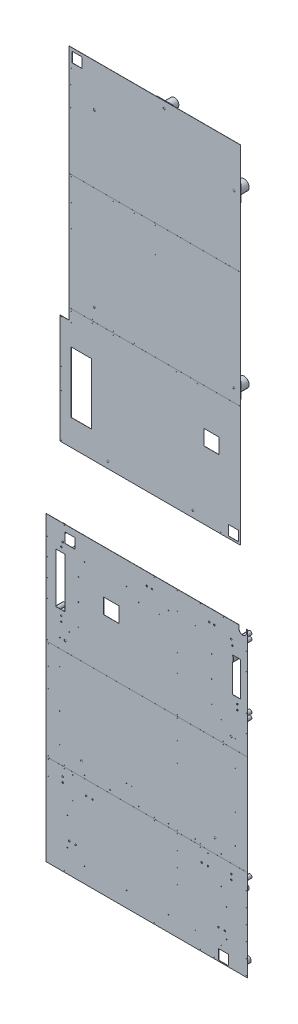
SolidWorks part; units mm, degrees
ref_plane "Plan de face" through (0, 0, 0) normal (0, 0, 1) x (1, 0, 0)
ref_plane "Plan de dessus" through (0, 0, 0) normal (0, 1, 0) x (1, 0, 0)
ref_plane "Plan de droite" through (0, 0, 0) normal (1, 0, 0) x (0, 0, -1)
sketch "Esquisse1" plane through (0, 0, 0) normal (0, 0, 1) x (1, 0, 0)
  line L4 (-30274.8157, 61703.558) -> (-30274.8157, 64815.0579)
  line L5 (-32386.0649, 61703.558) -> (-30274.8157, 61703.558)
  line L6 (-32386.0649, 64815.0579) -> (-32386.0649, 61703.558)
  line L7 (-30413.5787, 64815.0579) -> (-32386.0649, 64815.0579)
  line L11 (-30274.8157, 64815.0579) -> (-30338.5787, 64815.0579)
  line L12 (-30338.5787, 64815.0579) -> (-30338.5787, 64781.658)
  line L13 (-30413.5787, 64781.658) -> (-30413.5787, 64815.0579)
  line L15 (-30398.0256, 64522.8486) -> (-30479.4053, 64522.8486)
  line L16 (-30398.0256, 64522.8486) -> (-30398.0256, 64180.3914)
  line L17 (-30398.0256, 64180.3914) -> (-30479.4053, 64180.3914)
  line L18 (-30479.4053, 64522.8486) -> (-30479.4053, 64180.3914)
  line L19 (-31610.4628, 64380.1958) -> (-31762.7676, 64380.1958)
  line L20 (-31610.4628, 64380.1958) -> (-31610.4628, 64227.6279)
  line L21 (-31610.4628, 64227.6279) -> (-31762.7676, 64227.6279)
  line L22 (-31762.7676, 64380.1958) -> (-31762.7676, 64227.6279)
  line L23 (-32148.6171, 64557.0087) -> (-32238.8866, 64557.0087)
  line L24 (-32148.6171, 64557.0087) -> (-32148.6171, 64059.3316)
  line L25 (-32148.6171, 64059.3316) -> (-32238.8866, 64059.3316)
  line L26 (-32238.8866, 64557.0087) -> (-32238.8866, 64059.3316)
  arc A1 (-30413.5787, 64781.658) -> (-30338.5787, 64781.658) centre (-30376.0787, 64781.658) ccw
  arc A2 (-30413.5787, 64781.658) -> (-30338.5787, 64781.658) centre (-30376.0787, 64781.658) ccw construction
extrude "Boss.-Extru.1" add sketch "Esquisse1" along normal blind 1.5
hole_wizard "43 M4 K" positions "Esquisse3" profile "Esquisse4" tap size "M4" standard "ISO"
sketch "Esquisse3" plane through (0, 0, 1.5) normal (0, 0, 1) x (1, 0, 0)
  point P0 (-31954.79, 64586.5543)
  point P3 (-31535.2771, 64585.3859)
  point P6 (-31413.4414, 64507.7294)
  point P9 (-31210.0566, 64507.7294)
  point P12 (-31116.2214, 64586.6559)
  point P15 (-30849.4479, 64589.0943)
  point P18 (-30684.3889, 64427.7727)
  point P21 (-30684.3889, 64210.4793)
  point P24 (-30684.3889, 63992.1698)
  point P27 (-30590.4069, 63905.6267)
  point P30 (-30449.4874, 63811.7454)
  point P33 (-30449.4874, 63557.7454)
  point P36 (-30449.4874, 63176.7454)
  point P39 (-30449.4874, 62884.6649)
  point P42 (-30590.4069, 62744.9565)
  point P45 (-30722.3575, 62686.4873)
  point P48 (-30849.4479, 62744.9565)
  point P51 (-31116.2218, 62744.9565)
  point P54 (-31413.4414, 62744.9565)
  point P57 (-31484.4778, 62884.6649)
  point P60 (-31535.2771, 62885.1454)
  point P63 (-31700.3847, 62744.9565)
  point P66 (-31954.79, 62743.7881)
  point P69 (-32071.2906, 62686.4873)
  point P72 (-32200.8831, 62884.6649)
  point P75 (-32200.8831, 63176.7454)
  point P78 (-32200.8831, 63557.7454)
  point P81 (-32199.593, 63811.7454)
  point P84 (-32106.776, 63905.6267)
  point P87 (-32015.2956, 63992.1698)
  point P90 (-32015.2956, 64210.4793)
  point P93 (-32015.2956, 64427.7727)
  point P96 (-32071.1236, 62465.6107)
  point P99 (-32124.6441, 62313.2688)
  point P102 (-32124.5688, 62033.7601)
  point P105 (-31954.79, 61957.5524)
  point P108 (-31535.2771, 61958.3118)
  point P111 (-31116.2218, 61957.5524)
  point P114 (-30849.4479, 61957.5524)
  point P117 (-30590.4069, 61957.5524)
  point P120 (-30537.1513, 62033.7601)
  point P123 (-30537.0761, 62313.2688)
  point P126 (-30590.4069, 62465.6107)
sketch "Esquisse4" plane through (-31954.79, 64586.5543, 1.5) normal (1, 0, 0) x (0, -1, 0)
  line L0 (0, 0) -> (0, 12.4914)
  line L1 (0, 12.4914) -> (1.65, 11.5)
  line L2 (1.65, 11.5) -> (1.65, 0)
  line L5 (1.65, 0) -> (0, 0)
  line L10 (0, 12.4914) -> (-1.65, 11.5) construction
  line L11 (0, -6.35) -> (0, 107.95) construction
  dimension "Diamètre du trou pour taraudage" = 3.3
  dimension "Profondeur du trou pour taraudage" = 11.5
  dimension "Angle de pointe" = 118
hole_wizard "Dégagement 24xM12" positions "Esquisse5" profile "Esquisse6" hole size "M14" standard "ISO"
sketch "Esquisse5" plane through (0, 0, 1.5) normal (0, 0, 1) x (1, 0, 0)
  point P0 (-32172.1899, 64652.1668)
  point P3 (-32185.7029, 64603.1405)
  point P6 (-31332.2615, 64690.7484)
  point P9 (-31281.4615, 64690.7484)
  point P12 (-30709.9615, 64690.7484)
  point P15 (-30659.1615, 64690.7484)
  point P18 (-30492.237, 64652.153)
  point P21 (-30478.5726, 64603.2863)
  point P24 (-30429.1641, 64069.7197)
  point P27 (-30429.1665, 64120.5663)
  point P30 (-30488.3987, 62623.0581)
  point P33 (-30488.3987, 62572.2581)
  point P36 (-30722.2589, 62575.083)
  point P39 (-30785.7589, 62575.083)
  point P42 (-31875.0887, 62575.083)
  point P45 (-31938.5887, 62575.083)
  point P48 (-32172.6372, 62572.3851)
  point P51 (-32172.6372, 62623.1851)
  point P54 (-32186.8864, 63955.417)
  point P57 (-32186.8888, 64006.2636)
  point P60 (-32106.5081, 62098.96)
  point P63 (-32043.0081, 62098.96)
  point P66 (-30617.5601, 62098.96)
  point P69 (-30554.0601, 62098.96)
sketch "Esquisse6" plane through (-32172.1899, 64652.1668, 1.5) normal (1, 0, 0) x (0, -1, 0)
  line L0 (0, 0) -> (0, 16.0065)
  line L1 (0, 16.0065) -> (7.5, 11.5)
  line L2 (7.5, 11.5) -> (7.5, 0)
  line L5 (7.5, 0) -> (0, 0)
  line L10 (0, 16.0065) -> (-7.5, 11.5) construction
  line L11 (0, -6.35) -> (0, 107.95) construction
  dimension "Diamètre du perçage" = 15
  dimension "Profondeur du perçage" = 11.5
  dimension "Angle de pointe" = 118
hole_wizard "Dégagement 4x M18" positions "Esquisse7" profile "Esquisse8" hole size "M20" standard "ISO"
sketch "Esquisse7" plane through (0, 0, 1.5) normal (0, 0, 1) x (1, 0, 0)
  point P0 (-31983.7711, 62855.4119)
  point P3 (-30652.2523, 62855.4119)
  point P6 (-30489.6923, 63812.4331)
  point P9 (-32146.3311, 63812.4331)
sketch "Esquisse8" plane through (-31983.7711, 62855.4119, 1.5) normal (1, 0, 0) x (0, -1, 0)
  line L0 (0, 0) -> (0, 18.1095)
  line L1 (0, 18.1095) -> (11, 11.5)
  line L2 (11, 11.5) -> (11, 0)
  line L5 (11, 0) -> (0, 0)
  line L10 (0, 18.1095) -> (-11, 11.5) construction
  line L11 (0, -6.35) -> (0, 107.95) construction
  dimension "Diamètre du perçage" = 22
  dimension "Profondeur du perçage" = 11.5
  dimension "Angle de pointe" = 118
sketch "Esquisse9" plane through (0, 0, 1.5) normal (0, 0, 1) x (1, 0, 0)
  line L1 (-32197.6223, 66600.1627) -> (-30397.6223, 66600.1627)
  line L2 (-32197.6223, 66600.1627) -> (-32197.6223, 65510.1627)
  line L3 (-32197.6223, 65510.1627) -> (-30397.6223, 65510.1627)
  line L4 (-30397.6223, 66600.1627) -> (-30397.6223, 65510.1627)
  line L5 (-32107.6223, 66600.2627) -> (-30397.6223, 66600.2627)
  line L6 (-32107.6223, 66600.2627) -> (-32107.6223, 68970.1627)
  line L7 (-32107.6223, 68970.1627) -> (-30397.6223, 68970.1627)
  line L8 (-30397.6223, 66600.2627) -> (-30397.6223, 68970.1627)
  line L9 (-32087.6223, 66379.8355) -> (-31884.4368, 66379.8355)
  line L10 (-32087.6223, 66379.8355) -> (-32087.6223, 65770.2789)
  line L11 (-32087.6223, 65770.2789) -> (-31884.4368, 65770.2789)
  line L12 (-31884.4368, 66379.8355) -> (-31884.4368, 65770.2789)
  line L13 (-30764.4609, 66338.3373) -> (-30612.0718, 66338.3373)
  line L14 (-30764.4609, 66338.3373) -> (-30764.4609, 66185.9479)
  line L15 (-30764.4609, 66185.9479) -> (-30612.0718, 66185.9479)
  line L16 (-30612.0718, 66338.3373) -> (-30612.0718, 66185.9479)
  point P12 (-30427.6223, 68930.1627)
  point P13 (-30972.168, 65540.1627)
  dimension "D1" = 40
  dimension "D2" = 30
  dimension "D3" = 1710
  dimension "D4" = 30
  dimension "D5" = 0.1
  dimension "D6" = 1800
  dimension "D7" = 1090
extrude "Boss.-Extru.2" add sketch "Esquisse9" against normal up to surface (1.5 mm away) separate body
hole_wizard "Dégagement M202" positions "Esquisse10" profile "Esquisse11" hole size "M20" standard "ISO"
sketch "Esquisse10" plane through (0, 0, 1.5) normal (0, 0, 1) x (1, 0, 0)
  point P0 (-30463.5822, 68544.1973)
  point P3 (-31158.9847, 68906.1215)
  point P6 (-31854.3872, 68544.1973)
  point P9 (-31854.3872, 66839.3436)
  point P12 (-30463.5822, 66839.3436)
  point P15 (-31720.6404, 65575.7835)
  point P18 (-30872.3407, 65575.7835)
sketch "Esquisse11" plane through (-30463.5822, 68544.1973, 1.5) normal (1, 0, 0) x (0, -1, 0)
  line L0 (0, 0) -> (0, 18.1095)
  line L1 (0, 18.1095) -> (11, 11.5)
  line L2 (11, 11.5) -> (11, 0)
  line L5 (11, 0) -> (0, 0)
  line L10 (0, 18.1095) -> (-11, 11.5) construction
  line L11 (0, -6.35) -> (0, 107.95) construction
  dimension "Diamètre du perçage" = 22
  dimension "Profondeur du perçage" = 11.5
  dimension "Angle de pointe" = 118
sketch "Esquisse12" plane through (0, 0, 0) normal (0, 0, -1) x (-1, 0, 0)
  line L1 (32174.2711, 63866.4081) -> (32061.8311, 63866.4081)
  line L2 (32174.2711, 63866.4081) -> (32174.2711, 63754.9331)
  line L3 (32174.2711, 63754.9331) -> (32061.8311, 63754.9331)
  line L4 (32061.8311, 63866.4081) -> (32061.8311, 63754.9331)
  line L5 (30574.1816, 63869.7909) -> (30459.1923, 63869.7909)
  line L6 (30574.1816, 63869.7909) -> (30574.1816, 63754.9331)
  line L7 (30574.1816, 63754.9331) -> (30459.1923, 63754.9331)
  line L12 (30459.1923, 63869.7909) -> (30459.1923, 63754.9331)
  line L13 (32041.0408, 62939.0366) -> (31929.7961, 62939.0366)
  line L14 (32041.0408, 62939.0366) -> (32041.0408, 62827.6128)
  line L15 (32041.0408, 62827.6128) -> (31929.7961, 62827.6128)
  line L20 (31929.7961, 62939.0366) -> (31929.7961, 62827.6128)
  line L21 (30594.8555, 62939.8358) -> (30706.2273, 62939.8358)
  line L22 (30594.8555, 62939.8358) -> (30594.8555, 62827.4719)
  line L23 (30594.8555, 62827.4719) -> (30706.2273, 62827.4719)
  line L28 (30706.2273, 62939.8358) -> (30706.2273, 62827.4719)
  circle A0 centre (30520.69, 64488.182) radius 52.524 construction
  circle A1 centre (30684.5431, 64599.6577) radius 25.3982 construction
  circle A2 centre (31306.7988, 64599.6577) radius 25.3982
  circle A3 centre (31306.7988, 64599.6577) radius 25.3982 construction
  circle A4 centre (30684.5431, 64599.6577) radius 25.3982
  circle A5 centre (32094.1428, 64599.6577) radius 25.3982 construction
  circle A6 centre (30424.9787, 61870.558) radius 31.75
  circle A7 centre (32095.4901, 64488.6966) radius 52.524 construction
  circle A8 centre (30444.9787, 62483.658) radius 31.75
  circle A9 centre (32094.1428, 64152.6495) radius 25.3982 construction
  circle A10 centre (32219.1687, 62483.658) radius 31.75
  circle A11 centre (32095.4901, 64025.4006) radius 52.524 construction
  circle A12 centre (32239.1737, 61870.558) radius 31.75
  circle A13 centre (30520.69, 64025.2597) radius 52.524 construction
  circle A14 centre (30520.69, 64025.2597) radius 52.524
  circle A15 centre (32219.1687, 62483.658) radius 31.75 construction
  circle A16 centre (30520.69, 64488.182) radius 52.524
  circle A17 centre (30444.9787, 62483.658) radius 31.75 construction
  circle A18 centre (32095.4901, 64488.6966) radius 52.524
  circle A19 centre (32239.1737, 61870.558) radius 31.75 construction
  circle A20 centre (32095.4901, 64025.4006) radius 52.524
  circle A21 centre (30424.9787, 61870.558) radius 31.75 construction
  circle A22 centre (32094.1428, 64152.6495) radius 25.3982
  circle A24 centre (32094.1428, 64599.6577) radius 25.3982
extrude "PIED32" add sketch "Esquisse12" along normal blind 100 separate body
sketch "Esquisse13" plane through (0, 0, 0) normal (0, 0, -1) x (-1, 0, 0)
  circle A0 centre (30404.5787, 62597.658) radius 18.8884 construction
  circle A1 centre (32259.5787, 62597.658) radius 18.8884 construction
  circle A2 centre (30404.5787, 62597.658) radius 18.8884
  circle A3 centre (32259.5787, 63970.158) radius 18.8884 construction
  circle A4 centre (32259.5787, 62597.658) radius 18.8884
  circle A5 centre (32259.5787, 64020.158) radius 18.8884 construction
  circle A6 centre (32259.5787, 63970.158) radius 18.8884
  circle A7 centre (32259.5787, 64650.158) radius 18.8884 construction
  circle A8 centre (32259.5787, 64020.158) radius 18.8884
  circle A9 centre (32259.5787, 64700.158) radius 18.8884 construction
  circle A10 centre (30404.5787, 63970.158) radius 18.8884
  circle A11 centre (30404.5787, 64650.158) radius 18.8884 construction
  circle A12 centre (30404.5787, 64020.158) radius 18.8884
  circle A13 centre (30404.5786, 64700.158) radius 18.8884 construction
  circle A14 centre (30404.5787, 64650.158) radius 18.8884
  circle A15 centre (30404.5787, 63970.158) radius 18.8884 construction
  circle A16 centre (30404.5786, 64700.158) radius 18.8884
  circle A17 centre (30404.5787, 64020.158) radius 18.8884 construction
  circle A18 centre (32259.5787, 64700.158) radius 18.8884
  circle A20 centre (32259.5787, 64650.158) radius 18.8884
extrude "PIED4" add sketch "Esquisse13" along normal blind 100 separate body
sketch "Esquisse14" plane through (0, 0, 0) normal (0, 0, -1) x (-1, 0, 0)
  circle A0 centre (30463.5822, 68544.1973) radius 50.7964 construction
  arc A1 (30612.9236, 68759.3792) -> (30634.2347, 68756.8847) centre (30622.3209, 68747.3828) ccw construction
  circle A2 centre (31720.6404, 65575.7835) radius 50.7964
  circle A3 centre (31158.9847, 68906.1215) radius 44.1929 construction
  circle A4 centre (30872.3407, 65575.7835) radius 50.7964
  arc A5 (31683.7347, 68756.8847) -> (31705.0459, 68759.3792) centre (31695.6485, 68747.3828) ccw construction
  circle A6 centre (31695.6485, 68747.3828) radius 15.2389
  circle A7 centre (31854.3872, 68544.1973) radius 50.7964 construction
  circle A8 centre (30580.2615, 66534.5653) radius 25.3982
  circle A9 centre (31854.3872, 66839.3436) radius 50.7964 construction
  circle A10 centre (32019.0691, 66534.5653) radius 25.3982
  circle A11 centre (32019.0691, 66534.5653) radius 25.3982 construction
  circle A12 centre (31854.3872, 68544.1973) radius 50.7964
  circle A13 centre (30580.2615, 66534.5653) radius 25.3982 construction
  circle A14 centre (30463.5822, 68544.1973) radius 50.7964
  circle A15 centre (30463.5822, 66839.3436) radius 50.7964 construction
  circle A16 centre (31854.3872, 66839.3436) radius 50.7964
  circle A17 centre (31543.2594, 65759.9204) radius 50.7964 construction
  circle A18 centre (30463.5822, 66839.3436) radius 50.7964
  arc A19 (31669.844, 65575.7835) -> (31765.1877, 65600.1927) centre (31720.6404, 65575.7835) ccw construction
  circle A20 centre (31543.2594, 65759.9204) radius 50.7964
  circle A21 centre (30872.3407, 65575.7835) radius 50.7964 construction
  circle A22 centre (31158.9847, 68906.1215) radius 44.1929
  circle A24 centre (30622.3209, 68747.3828) radius 15.2389
extrude "PIED1" add sketch "Esquisse14" along normal blind 100 separate body
sketch "Esquisse15" plane through (0, 0, 0) normal (0, 0, -1) x (-1, 0, 0)
  line L8 (30546.1263, 68461.6531) -> (30546.1263, 68626.7414)
  line L9 (30546.1263, 68626.7414) -> (30403.2615, 68626.7414)
  line L10 (30403.2615, 68626.7414) -> (30403.2615, 68461.6531)
  line L11 (30403.2615, 68461.6531) -> (30546.1263, 68461.6531)
  line L16 (31076.4406, 68823.5774) -> (31241.5289, 68823.5774)
  line L17 (31076.4406, 68966.4422) -> (31076.4406, 68823.5774)
  line L18 (31241.5289, 68966.4422) -> (31076.4406, 68966.4422)
  line L19 (31241.5289, 68823.5774) -> (31241.5289, 68966.4422)
  line L24 (31914.708, 68626.7414) -> (31771.8431, 68626.7414)
  line L25 (31914.708, 68461.6531) -> (31914.708, 68626.7414)
  line L26 (31771.8431, 68461.6531) -> (31914.708, 68461.6531)
  line L27 (31771.8431, 68626.7414) -> (31771.8431, 68461.6531)
  line L32 (30403.2615, 66763.149) -> (30546.1263, 66763.149)
  line L33 (30403.2615, 66921.8877) -> (30403.2615, 66763.149)
  line L34 (30546.1263, 66921.8877) -> (30403.2615, 66921.8877)
  line L35 (30546.1263, 66763.149) -> (30546.1263, 66921.8877)
  line L40 (31914.708, 66921.8877) -> (31771.8431, 66921.8877)
  line L41 (31771.8431, 66921.8877) -> (31771.8431, 66756.7994)
  line L42 (31771.8431, 66756.7994) -> (31914.708, 66756.7994)
  line L43 (31914.708, 66756.7994) -> (31914.708, 66921.8877)
  line L48 (31803.1845, 65639.279) -> (31638.0962, 65639.279)
  line L49 (31638.0962, 65639.279) -> (31638.0962, 65515.4628)
  line L50 (31638.0962, 65515.4628) -> (31803.1845, 65515.4628)
  line L51 (31803.1845, 65515.4628) -> (31803.1845, 65639.279)
  line L56 (30954.8849, 65639.279) -> (30789.7966, 65639.279)
  line L57 (30789.7966, 65639.279) -> (30789.7966, 65515.4628)
  line L58 (30789.7966, 65515.4628) -> (30954.8849, 65515.4628)
  line L59 (30954.8849, 65515.4628) -> (30954.8849, 65639.279)
  circle A2 centre (30463.5822, 68544.1973) radius 50.7964
  circle A4 centre (31854.3872, 68544.1973) radius 50.7964
  circle A6 centre (31158.9847, 68906.1215) radius 44.1929
  circle A8 centre (31854.3872, 66839.3436) radius 50.7964
  circle A10 centre (30463.5822, 66839.3436) radius 50.7964
  circle A12 centre (31720.6404, 65575.7835) radius 50.7964
  circle A14 centre (30872.3407, 65575.7835) radius 50.7964
extrude "PIED2" add sketch "Esquisse15" along normal blind 10 separate body
sketch "Esquisse16" plane through (0, 0, 0) normal (0, 0, -1) x (-1, 0, 0)
  line L0 (31610.4628, 64380.1958) -> (31762.7676, 64380.1958) construction
  line L1 (31600.4628, 64390.1958) -> (31772.7676, 64390.1958)
  line L2 (31600.4628, 64390.1958) -> (31600.4628, 64217.6279)
  line L3 (31600.4628, 64217.6279) -> (31772.7676, 64217.6279)
  line L4 (31772.7676, 64390.1958) -> (31772.7676, 64217.6279)
  line L5 (31762.7676, 64227.6279) -> (31610.4628, 64227.6279) construction
  line L6 (31610.4628, 64227.6279) -> (31610.4628, 64380.1958) construction
  line L7 (31762.7676, 64380.1958) -> (31762.7676, 64227.6279) construction
  dimension "D1" = 10
  dimension "D2" = 10
  dimension "D3" = 10
  dimension "D4" = 10
sketch "Esquisse17" plane through (0, 0, 0) normal (0, 0, -1) x (-1, 0, 0)
  line L1 (30274.8157, 61703.558) -> (32386.0649, 61703.558)
  line L2 (30274.8157, 61703.558) -> (30274.8157, 61805.1634)
  line L3 (30274.8157, 61805.1634) -> (32386.0649, 61805.1634)
  line L4 (32386.0649, 61703.558) -> (32386.0649, 61805.1634)
  dimension "D1" = 101.6054
extrude "Enlèv. mat.-Extru.1" cut sketch "Esquisse17" against normal blind 10
sketch "Esquisse18" plane through (0, 0, 1.5) normal (0, 0, 1) x (1, 0, 0)
  line L1 (-30274.8157, 64815.0579) -> (-30328.0257, 64815.0579)
  line L2 (-30274.8157, 64815.0579) -> (-30274.8157, 61805.1634)
  line L3 (-30274.8157, 61805.1634) -> (-30328.0257, 61805.1634)
  line L4 (-30328.0257, 64815.0579) -> (-30328.0257, 61805.1634)
  line L5 (-32386.0649, 61805.1634) -> (-32338.0249, 61805.1634)
  line L6 (-32386.0649, 61805.1634) -> (-32386.0649, 64815.0579)
  line L7 (-32386.0649, 64815.0579) -> (-32338.0249, 64815.0579)
  line L8 (-32338.0249, 61805.1634) -> (-32338.0249, 64815.0579)
  dimension "D1" = 48.04
  dimension "D2" = 53.21
extrude "Enlèv. mat.-Extru.2" cut sketch "Esquisse18" against normal blind 10
sketch "Esquisse19" plane through (0, 64815.0579, 0) normal (0, 1, 0) x (1, 0, 0)
  line L4 (-30413.5787, 0) -> (-32338.0249, 0)
  line L5 (-32338.0249, 0) -> (-32338.0249, -1.5)
  line L6 (-32338.0249, -1.5) -> (-30413.5787, -1.5)
  line L7 (-30413.5787, -1.5) -> (-30413.5787, 0)
  line L8 (-30413.5787, 0) -> (-32338.0249, 0)
  line L9 (-32338.0249, 0) -> (-32338.0249, -1.5)
  line L10 (-32338.0249, -1.5) -> (-30413.5787, -1.5)
  line L11 (-30413.5787, -1.5) -> (-30413.5787, 0)
  line L12 (-30338.5787, -1.5) -> (-30328.0257, -1.5)
  line L13 (-30328.0257, -1.5) -> (-30328.0257, 0)
  line L14 (-30328.0257, 0) -> (-30338.5787, 0)
  line L15 (-30338.5787, 0) -> (-30338.5787, -1.5)
  line L16 (-30338.5787, -1.5) -> (-30328.0257, -1.5)
  line L17 (-30328.0257, -1.5) -> (-30328.0257, 0)
  line L18 (-30328.0257, 0) -> (-30338.5787, 0)
  line L19 (-30338.5787, 0) -> (-30338.5787, -1.5)
  dimension "D1" = 0
  dimension "D2" = 0
extrude "Boss.-Extru.7" add sketch "Esquisse19" along normal blind 0.1
sketch "Esquisse20" plane through (0, 0, 0) normal (0, 0, -1) x (-1, 0, 0)
  line L0 (30546.1263, 66763.149) -> (30546.1263, 66921.8877) construction
  line L1 (30546.1263, 66921.8877) -> (30403.2615, 66921.8877) construction
  line L2 (30403.2615, 66921.8877) -> (30403.2615, 66763.149) construction
  line L3 (30403.2615, 66763.149) -> (30546.1263, 66763.149) construction
  line L4 (31914.708, 66756.7994) -> (31914.708, 66921.8877) construction
  line L5 (31914.708, 66921.8877) -> (31771.8431, 66921.8877) construction
  line L6 (31771.8431, 66921.8877) -> (31771.8431, 66756.7994) construction
  line L7 (31771.8431, 66756.7994) -> (31914.708, 66756.7994) construction
  line L8 (30954.8849, 65515.4628) -> (30954.8849, 65639.279) construction
  line L9 (30954.8849, 65639.279) -> (30789.7966, 65639.279) construction
  line L10 (30789.7966, 65639.279) -> (30789.7966, 65515.4628) construction
  line L11 (30789.7966, 65515.4628) -> (30954.8849, 65515.4628) construction
  line L12 (31803.1845, 65515.4628) -> (31803.1845, 65639.279) construction
  line L13 (31803.1845, 65639.279) -> (31638.0962, 65639.279) construction
  line L14 (31638.0962, 65639.279) -> (31638.0962, 65515.4628) construction
  line L15 (31638.0962, 65515.4628) -> (31803.1845, 65515.4628) construction
  line L16 (30546.1263, 66763.149) -> (30546.1263, 66921.8877)
  line L17 (30546.1263, 66921.8877) -> (30403.2615, 66921.8877)
  line L18 (30403.2615, 66921.8877) -> (30403.2615, 66763.149)
  line L19 (30403.2615, 66763.149) -> (30546.1263, 66763.149)
  line L20 (31914.708, 66756.7994) -> (31914.708, 66921.8877)
  line L21 (31914.708, 66921.8877) -> (31771.8431, 66921.8877)
  line L22 (31771.8431, 66921.8877) -> (31771.8431, 66756.7994)
  line L23 (31771.8431, 66756.7994) -> (31914.708, 66756.7994)
  line L24 (30954.8849, 65515.4628) -> (30954.8849, 65639.279)
  line L25 (30954.8849, 65639.279) -> (30789.7966, 65639.279)
  line L26 (30789.7966, 65639.279) -> (30789.7966, 65515.4628)
  line L27 (30789.7966, 65515.4628) -> (30954.8849, 65515.4628)
  line L28 (31803.1845, 65515.4628) -> (31803.1845, 65639.279)
  line L29 (31803.1845, 65639.279) -> (31638.0962, 65639.279)
  line L30 (31638.0962, 65639.279) -> (31638.0962, 65515.4628)
  line L31 (31638.0962, 65515.4628) -> (31803.1845, 65515.4628)
  line L32 (30403.2615, 68461.6531) -> (30546.1263, 68461.6531) construction
  line L33 (30546.1263, 68461.6531) -> (30546.1263, 68626.7414) construction
  line L34 (30546.1263, 68626.7414) -> (30403.2615, 68626.7414) construction
  line L35 (30403.2615, 68626.7414) -> (30403.2615, 68461.6531) construction
  line L36 (31241.5289, 68823.5774) -> (31241.5289, 68966.4422) construction
  line L37 (31241.5289, 68966.4422) -> (31076.4406, 68966.4422) construction
  line L38 (31076.4406, 68966.4422) -> (31076.4406, 68823.5774) construction
  line L39 (31076.4406, 68823.5774) -> (31241.5289, 68823.5774) construction
  line L40 (31914.708, 68461.6531) -> (31914.708, 68626.7414) construction
  line L41 (31914.708, 68626.7414) -> (31771.8431, 68626.7414) construction
  line L42 (31771.8431, 68626.7414) -> (31771.8431, 68461.6531) construction
  line L43 (31771.8431, 68461.6531) -> (31914.708, 68461.6531) construction
  line L44 (30403.2615, 68461.6531) -> (30546.1263, 68461.6531)
  line L45 (30546.1263, 68461.6531) -> (30546.1263, 68626.7414)
  line L46 (30546.1263, 68626.7414) -> (30403.2615, 68626.7414)
  line L47 (30403.2615, 68626.7414) -> (30403.2615, 68461.6531)
  line L48 (31241.5289, 68823.5774) -> (31241.5289, 68966.4422)
  line L49 (31241.5289, 68966.4422) -> (31076.4406, 68966.4422)
  line L50 (31076.4406, 68966.4422) -> (31076.4406, 68823.5774)
  line L51 (31076.4406, 68823.5774) -> (31241.5289, 68823.5774)
  line L52 (31914.708, 68461.6531) -> (31914.708, 68626.7414)
  line L53 (31914.708, 68626.7414) -> (31771.8431, 68626.7414)
  line L54 (31771.8431, 68626.7414) -> (31771.8431, 68461.6531)
  line L55 (31771.8431, 68461.6531) -> (31914.708, 68461.6531)
  circle A0 centre (30580.2615, 66534.5653) radius 25.3982 construction
  circle A1 centre (32019.0691, 66534.5653) radius 25.3982 construction
  circle A2 centre (31543.2594, 65759.9204) radius 50.7964 construction
  circle A3 centre (30580.2615, 66534.5653) radius 25.3982
  circle A4 centre (32019.0691, 66534.5653) radius 25.3982
  circle A5 centre (31543.2594, 65759.9204) radius 50.7964
  circle A6 centre (30872.3407, 65575.7835) radius 50.7964 construction
  circle A7 centre (31720.6404, 65575.7835) radius 50.7964 construction
  circle A8 centre (31854.3872, 66839.3436) radius 50.7964 construction
  circle A9 centre (30463.5822, 66839.3436) radius 50.7964 construction
  circle A10 centre (30463.5822, 68544.1973) radius 50.7964 construction
  circle A11 centre (30622.3209, 68747.3828) radius 15.2389 construction
  circle A12 centre (31854.3872, 68544.1973) radius 50.7964 construction
  circle A13 centre (31158.9847, 68906.1215) radius 44.1929 construction
  circle A14 centre (31695.6485, 68747.3828) radius 15.2389 construction
  circle A15 centre (30872.3407, 65575.7835) radius 50.7964
  circle A16 centre (31720.6404, 65575.7835) radius 50.7964
  circle A17 centre (31854.3872, 66839.3436) radius 50.7964
  circle A18 centre (30463.5822, 66839.3436) radius 50.7964
  circle A19 centre (30463.5822, 68544.1973) radius 50.7964
  circle A20 centre (30622.3209, 68747.3828) radius 15.2389
  circle A21 centre (31854.3872, 68544.1973) radius 50.7964
  circle A22 centre (31158.9847, 68906.1215) radius 44.1929
  circle A23 centre (31695.6485, 68747.3828) radius 15.2389
sketch "Esquisse21" plane through (0, 0, 0) normal (0, 0, -1) x (-1, 0, 0)
  line L4 (30706.2273, 62939.8358) -> (30594.8555, 62939.8358)
  line L5 (30706.2273, 62827.4719) -> (30706.2273, 62939.8358)
  line L6 (30594.8555, 62827.4719) -> (30706.2273, 62827.4719)
  line L7 (30594.8555, 62939.8358) -> (30594.8555, 62827.4719)
  line L8 (30706.2273, 62939.8358) -> (30594.8555, 62939.8358)
  line L9 (30706.2273, 62827.4719) -> (30706.2273, 62939.8358)
  line L10 (30594.8555, 62827.4719) -> (30706.2273, 62827.4719)
  line L11 (30594.8555, 62939.8358) -> (30594.8555, 62827.4719)
  line L12 (32041.0408, 62939.0366) -> (31929.7961, 62939.0366)
  line L13 (32041.0408, 62827.6128) -> (32041.0408, 62939.0366)
  line L14 (31929.7961, 62827.6128) -> (32041.0408, 62827.6128)
  line L15 (31929.7961, 62939.0366) -> (31929.7961, 62827.6128)
  line L16 (32041.0408, 62939.0366) -> (31929.7961, 62939.0366)
  line L17 (32041.0408, 62827.6128) -> (32041.0408, 62939.0366)
  line L18 (31929.7961, 62827.6128) -> (32041.0408, 62827.6128)
  line L19 (31929.7961, 62939.0366) -> (31929.7961, 62827.6128)
  line L20 (32174.2711, 63866.4081) -> (32061.8311, 63866.4081)
  line L21 (32061.8311, 63866.4081) -> (32061.8311, 63754.9331)
  line L22 (32061.8311, 63754.9331) -> (32174.2711, 63754.9331)
  line L23 (32174.2711, 63754.9331) -> (32174.2711, 63866.4081)
  line L24 (32174.2711, 63866.4081) -> (32061.8311, 63866.4081)
  line L25 (32061.8311, 63866.4081) -> (32061.8311, 63754.9331)
  line L26 (32061.8311, 63754.9331) -> (32174.2711, 63754.9331)
  line L27 (32174.2711, 63754.9331) -> (32174.2711, 63866.4081)
  line L28 (30574.1816, 63869.7909) -> (30459.1923, 63869.7909)
  line L29 (30459.1923, 63869.7909) -> (30459.1923, 63754.9331)
  line L30 (30459.1923, 63754.9331) -> (30574.1816, 63754.9331)
  line L31 (30574.1816, 63754.9331) -> (30574.1816, 63869.7909)
  line L32 (30574.1816, 63869.7909) -> (30459.1923, 63869.7909)
  line L33 (30459.1923, 63869.7909) -> (30459.1923, 63754.9331)
  line L34 (30459.1923, 63754.9331) -> (30574.1816, 63754.9331)
  line L35 (30574.1816, 63754.9331) -> (30574.1816, 63869.7909)
  circle A1 centre (30444.9787, 62483.658) radius 31.75
  circle A2 centre (30444.9787, 62483.658) radius 31.75
  circle A3 centre (30424.9787, 61870.558) radius 31.75
  circle A4 centre (30424.9787, 61870.558) radius 31.75
  circle A5 centre (30684.5431, 64599.6577) radius 25.3982
  circle A6 centre (30684.5431, 64599.6577) radius 25.3982
  circle A7 centre (31306.7988, 64599.6577) radius 25.3982
  circle A8 centre (31306.7988, 64599.6577) radius 25.3982
  circle A9 centre (32095.4901, 64025.4006) radius 52.524
  circle A10 centre (32095.4901, 64025.4006) radius 52.524
  circle A11 centre (32095.4901, 64488.6966) radius 52.524
  circle A12 centre (32095.4901, 64488.6966) radius 52.524
  circle A13 centre (30520.69, 64488.182) radius 52.524
  circle A14 centre (30520.69, 64488.182) radius 52.524
  circle A15 centre (30520.69, 64025.2597) radius 52.524
  circle A16 centre (30520.69, 64025.2597) radius 52.524
  circle A17 centre (32239.1737, 61870.558) radius 31.75
  circle A18 centre (32239.1737, 61870.558) radius 31.75
  circle A19 centre (32219.1687, 62483.658) radius 31.75
  circle A20 centre (32219.1687, 62483.658) radius 31.75
  circle A21 centre (32094.1428, 64599.6577) radius 25.3982
  circle A22 centre (32094.1428, 64599.6577) radius 25.3982
  circle A23 centre (32094.1428, 64152.6495) radius 25.3982
  circle A24 centre (32094.1428, 64152.6495) radius 25.3982
  circle A25 centre (32259.5787, 64020.158) radius 18.8884
  circle A26 centre (32259.5787, 64020.158) radius 18.8884
  circle A27 centre (32259.5787, 63970.158) radius 18.8884
  circle A28 centre (32259.5787, 63970.158) radius 18.8884
  circle A29 centre (32259.5787, 62597.658) radius 18.8884
  circle A30 centre (32259.5787, 62597.658) radius 18.8884
  circle A31 centre (30404.5787, 62597.658) radius 18.8884
  circle A32 centre (30404.5787, 62597.658) radius 18.8884
  circle A33 centre (32259.5787, 64650.158) radius 18.8884
  circle A34 centre (32259.5787, 64650.158) radius 18.8884
  circle A35 centre (32259.5787, 64700.158) radius 18.8884
  circle A36 centre (32259.5787, 64700.158) radius 18.8884
  circle A37 centre (30404.5786, 64700.158) radius 18.8884
  circle A38 centre (30404.5786, 64700.158) radius 18.8884
  circle A39 centre (30404.5787, 64650.158) radius 18.8884
  circle A40 centre (30404.5787, 64650.158) radius 18.8884
  circle A41 centre (30404.5787, 64020.158) radius 18.8884
  circle A42 centre (30404.5787, 64020.158) radius 18.8884
  circle A43 centre (30404.5787, 63970.158) radius 18.8884
  circle A44 centre (30404.5787, 63970.158) radius 18.8884
  dimension "D1" = 0
  dimension "D2" = 0
  dimension "D3" = 0
  dimension "D4" = 0
  dimension "D5" = 0
  dimension "D6" = 0
  dimension "D7" = 0
  dimension "D8" = 0
  dimension "D9" = 0
  dimension "D10" = 0
  dimension "D11" = 0
  dimension "D12" = 0
  dimension "D13" = 0
  dimension "D14" = 0
  dimension "D15" = 0
  dimension "D16" = 0
  dimension "D17" = 0
  dimension "D18" = 0
  dimension "D19" = 0
  dimension "D20" = 0
  dimension "D21" = 0
  dimension "D22" = 0
  dimension "D23" = 0
  dimension "D24" = 0
  dimension "D25" = 0
  dimension "D26" = 0
sketch "Esquisse22" plane through (0, 0, 0) normal (0, 0, -1) x (-1, 0, 0)
  line L0 (30397.6223, 66600.1627) -> (30397.6223, 65510.1627) construction
  line L1 (31979.6223, 68938.1627) -> (32075.6223, 68938.1627)
  line L2 (31979.6223, 68938.1627) -> (31979.6223, 68842.1627)
  line L3 (31979.6223, 68842.1627) -> (32075.6223, 68842.1627)
  line L4 (32075.6223, 68938.1627) -> (32075.6223, 68842.1627)
  line L5 (30419.6223, 65628.1627) -> (30515.6223, 65628.1627)
  line L6 (30419.6223, 65628.1627) -> (30419.6223, 65532.1627)
  line L7 (30419.6223, 65532.1627) -> (30515.6223, 65532.1627)
  line L8 (30515.6223, 65628.1627) -> (30515.6223, 65532.1627)
  line L9 (32148.0256, 64748.1627) -> (32052.0256, 64748.1627)
  line L10 (32148.0256, 64748.1627) -> (32148.0256, 64652.1627)
  line L11 (32148.0256, 64652.1627) -> (32052.0256, 64652.1627)
  line L12 (32052.0256, 64748.1627) -> (32052.0256, 64652.1627)
  line L13 (30518.0256, 61913.1627) -> (30614.0256, 61913.1627)
  line L14 (30518.0256, 61913.1627) -> (30518.0256, 61817.1627)
  line L15 (30518.0256, 61817.1627) -> (30614.0256, 61817.1627)
  line L16 (30614.0256, 61913.1627) -> (30614.0256, 61817.1627)
  point P4 (32067.6223, 68930.1627)
  point P5 (30427.6223, 65540.1627)
  point P14 (32318.0256, 64740.1627)
  point P15 (30398.0256, 61825.1627)
  dimension "D1" = 8
  dimension "D2" = 8
  dimension "D3" = 96
  dimension "D4" = 96
  dimension "D5" = 8
  dimension "D6" = 22
  dimension "D7" = 8
  dimension "D8" = 170
  dimension "D9" = 8
  dimension "D10" = 120
extrude "Enlèv. mat.-Extru.3" cut sketch "Esquisse22" against normal blind 80
sketch "Esquisse24" plane through (0, 0, 0) normal (0, 0, -1) x (-1, 0, 0)
  line L0 (32107.6223, 66600.2627) -> (32107.6223, 68970.1627) construction
  line L1 (32107.6223, 66677.7048) -> (30397.6223, 66677.7048)
  line L2 (32107.6223, 66677.7048) -> (32107.6223, 66562.0675)
  line L3 (32107.6223, 66562.0675) -> (30397.6223, 66562.0675)
  line L4 (30397.6223, 66677.7048) -> (30397.6223, 66562.0675)
  line L5 (30397.6223, 66600.1627) -> (30397.6223, 65510.1627) construction
extrude "Boss.-Extru.8" add sketch "Esquisse24" against normal up to surface (1.5 mm away)
hole_wizard "Dégagement M51" positions "Esquisse30" profile "Esquisse31" hole size "M5" standard "ISO"
sketch "Esquisse30" plane through (0, 0, 0) normal (0, 0, -1) x (-1, 0, 0)
  point P0 (30684.3889, 64427.7727)
  point P5 (30849.4479, 64589.0943)
  point P7 (31116.2214, 64586.6559)
  point P9 (31210.0566, 64507.7294)
  point P11 (31413.4414, 64507.7294)
  point P13 (31535.2771, 64585.3859)
  point P15 (31954.79, 64586.5543)
  point P17 (32015.2956, 64427.7727)
  point P19 (32015.2956, 64210.4793)
  point P21 (32015.2956, 63992.1698)
  point P24 (32106.776, 63905.6267)
  point P27 (32199.593, 63811.7454)
  point P30 (32200.8831, 63557.7454)
  point P37 (32200.8831, 63176.7454)
  point P46 (32200.8831, 62884.6649)
  point P55 (31954.79, 62743.7881)
  point P60 (32071.2906, 62686.4873)
  point P63 (32071.1236, 62465.6107)
  point P66 (32124.6441, 62313.2688)
  point P69 (32124.5688, 62033.7601)
  point P72 (31954.79, 61957.5524)
  point P75 (31535.2771, 61958.3118)
  point P78 (31116.2218, 61957.5524)
  point P81 (30849.4479, 61957.5524)
  point P84 (30590.4069, 61957.5524)
  point P87 (30537.1513, 62033.7601)
  point P90 (30537.0761, 62313.2688)
  point P93 (30590.4069, 62465.6107)
  point P96 (30590.4069, 62744.9565)
  point P99 (30722.3575, 62686.4873)
  point P106 (30849.4479, 62744.9565)
  point P111 (31116.2218, 62744.9565)
  point P114 (31413.4414, 62744.9565)
  point P117 (31700.3847, 62744.9565)
  point P124 (31484.4778, 62884.6649)
  point P127 (31535.2771, 62885.1454)
  point P136 (30449.4874, 62884.6649)
  point P141 (30449.4874, 63176.7454)
  point P144 (30449.4874, 63557.7454)
  point P147 (30449.4874, 63811.7454)
  point P150 (30590.4069, 63905.6267)
  point P157 (30684.3889, 63992.1698)
  point P162 (30684.3889, 64210.4793)
sketch "Esquisse31" plane through (-30684.3889, 64427.7727, 0) normal (1, 0, 0) x (0, 1, 0)
  line L0 (0, 0) -> (0, 13.603)
  line L1 (0, 13.603) -> (3.5, 11.5)
  line L2 (3.5, 11.5) -> (3.5, 0)
  line L5 (3.5, 0) -> (0, 0)
  line L10 (0, 13.603) -> (-3.5, 11.5) construction
  line L11 (0, -6.35) -> (0, 107.95) construction
  dimension "Diamètre du perçage" = 7
  dimension "Profondeur du perçage" = 11.5
  dimension "Angle de pointe" = 118
sketch "Esquisse32" plane through (0, 0, 0) normal (0, 0, -1) x (-1, 0, 0)
  line L0 (30614.0256, 61913.1627) -> (30518.0256, 61913.1627) construction
  line L1 (32050.0256, 64750.1627) -> (32150.0256, 64750.1627)
  line L2 (32050.0256, 64750.1627) -> (32050.0256, 64650.1627)
  line L3 (32050.0256, 64650.1627) -> (32150.0256, 64650.1627)
  line L4 (32150.0256, 64750.1627) -> (32150.0256, 64650.1627)
  line L5 (30516.0256, 61915.1627) -> (30616.0256, 61915.1627)
  line L6 (30516.0256, 61915.1627) -> (30516.0256, 61815.1627)
  line L7 (30516.0256, 61815.1627) -> (30616.0256, 61815.1627)
  line L8 (30616.0256, 61915.1627) -> (30616.0256, 61815.1627)
  line L9 (31977.6223, 68940.1627) -> (32077.6223, 68940.1627)
  line L10 (31977.6223, 68940.1627) -> (31977.6223, 68840.1627)
  line L11 (31977.6223, 68840.1627) -> (32077.6223, 68840.1627)
  line L12 (32077.6223, 68940.1627) -> (32077.6223, 68840.1627)
  line L13 (30417.6223, 65630.1627) -> (30517.6223, 65630.1627)
  line L14 (30417.6223, 65630.1627) -> (30417.6223, 65530.1627)
  line L15 (30417.6223, 65530.1627) -> (30517.6223, 65530.1627)
  line L16 (30517.6223, 65630.1627) -> (30517.6223, 65530.1627)
  line L17 (30518.0256, 61913.1627) -> (30518.0256, 61817.1627) construction
  line L18 (32052.0256, 64652.1627) -> (32148.0256, 64652.1627) construction
  line L19 (32052.0256, 64748.1627) -> (32052.0256, 64652.1627) construction
  line L20 (30419.6223, 65628.1627) -> (30419.6223, 65532.1627) construction
  line L21 (30419.6223, 65532.1627) -> (30515.6223, 65532.1627) construction
  line L22 (31979.6223, 68842.1627) -> (32075.6223, 68842.1627) construction
  line L23 (31979.6223, 68938.1627) -> (31979.6223, 68842.1627) construction
  dimension "D1" = 2
  dimension "D2" = 2
  dimension "D3" = 100
  dimension "D4" = 2
  dimension "D5" = 2
  dimension "D6" = 2
  dimension "D7" = 2
  dimension "D8" = 2
  dimension "D9" = 2
extrude "Enlèv. mat.-Extru.5" cut sketch "Esquisse32" against normal blind 10
sketch "Esquisse33" plane through (0, 0, 0) normal (0, 0, -1) x (-1, 0, 0)
  line L0 (30397.6223, 67870.1627) -> (32107.6223, 67870.1627)
  line L1 (30397.6223, 68970.1627) -> (30397.6223, 65510.1627) construction
  line L2 (32107.6223, 66600.1627) -> (32107.6223, 68970.1627) construction
  line L3 (30328.0257, 63715.1579) -> (32338.0249, 63715.1579)
  line L4 (30397.6223, 66710.1627) -> (32107.6223, 66710.1627)
  line L5 (32107.6223, 68970.1627) -> (30397.6223, 68970.1627) construction
  line L8 (30328.0257, 64815.1579) -> (30328.0257, 61805.1634) construction
  line L9 (32338.0249, 61805.1634) -> (32338.0249, 64815.1579) construction
  line L11 (30328.0257, 62715.1579) -> (32338.0249, 62715.1579)
  line L12 (30413.5787, 64815.1579) -> (32338.0249, 64815.1579) construction
  dimension "D1" = 1100
  dimension "D2" = 1160
  dimension "D3" = 1100
  dimension "D4" = 1000
extrude "Enlèv. de mat.-Extru.-Mince1" cut sketch "Esquisse33" against normal blind 10 thin
sketch "Esquisse34" plane through (0, 0, 0) normal (0, 0, -1) x (-1, 0, 0)
  line L0 (32087.6223, 66590.1627) -> (32185.6223, 66590.1627)
  line L1 (30412.6223, 68953.1627) -> (30622.3723, 68953.1627)
  line L2 (30412.6223, 68953.1627) -> (30412.6223, 68798.1627)
  line L3 (30412.6223, 67890.2627) -> (30622.3723, 67890.2627)
  line L4 (32090.6223, 68953.1627) -> (32090.6223, 68798.1627)
  line L5 (30412.6223, 67850.0627) -> (30621.9973, 67850.0627)
  line L6 (30412.6223, 67850.0627) -> (30412.6223, 67625.1027)
  line L7 (30412.6223, 66725.2627) -> (30621.9973, 66725.2627)
  line L8 (32087.6223, 67850.0627) -> (32087.6223, 67625.1027)
  line L9 (30411.6223, 65524.1627) -> (30596.6223, 65524.1627)
  line L10 (30411.6223, 65524.1627) -> (30411.6223, 65757.3427)
  line L12 (32185.6223, 65524.1627) -> (32185.6223, 65737.3627)
  line L13 (30411.6223, 66690.0627) -> (30621.1223, 66690.0627)
  line L16 (32087.6223, 66690.0627) -> (32087.6223, 66590.1627)
  line L17 (30328.0257, 62715.0579) -> (30328.0257, 61805.1634) construction
  line L18 (32326.0249, 64803.1579) -> (30340.0257, 64803.1579)
  line L19 (32326.0249, 64803.1579) -> (32326.0249, 64624.3413)
  line L20 (32326.0249, 63730.2579) -> (32156.0249, 63730.2579)
  line L21 (30340.0257, 64803.1579) -> (30340.0257, 64624.3413)
  line L22 (30338.0257, 63700.0579) -> (32316.0249, 63700.0579)
  line L23 (30338.0257, 63700.0579) -> (30338.0257, 63506.0979)
  line L24 (30338.0257, 62730.2579) -> (32316.0249, 62730.2579)
  line L25 (32316.0249, 63700.0579) -> (32316.0249, 63506.0979)
  line L26 (32316.0249, 62700.0579) -> (30340.0257, 62700.0579)
  line L27 (32316.0249, 62700.0579) -> (32316.0249, 62553.0755)
  line L28 (32316.0249, 61818.1634) -> (30340.0257, 61818.1634)
  line L29 (30340.0257, 62700.0579) -> (30340.0257, 62553.0755)
  line L30 (32338.0249, 61805.1634) -> (30328.0257, 61805.1634) construction
  line L31 (32338.0249, 61805.1634) -> (32338.0249, 62715.0579) construction
  line L32 (32338.0249, 63715.2579) -> (32338.0249, 64815.1579) construction
  line L33 (30413.5787, 64815.1579) -> (32338.0249, 64815.1579) construction
  line L34 (30328.0257, 63715.0579) -> (30328.0257, 62715.2579) construction
  line L35 (30328.0257, 64815.1579) -> (30328.0257, 63715.2579) construction
  line L36 (30328.0257, 63715.2579) -> (32338.0249, 63715.2579) construction
  line L37 (30328.0257, 63715.0579) -> (32338.0249, 63715.0579) construction
  line L38 (30328.0257, 62715.2579) -> (32338.0249, 62715.2579) construction
  line L39 (30328.0257, 62715.0579) -> (32338.0249, 62715.0579) construction
  line L40 (30397.6223, 65510.1627) -> (32197.6223, 65510.1627) construction
  line L41 (30397.6223, 66710.0627) -> (30397.6223, 65510.1627) construction
  line L42 (32197.6223, 65510.1627) -> (32197.6223, 66600.1627) construction
  line L43 (32197.6223, 66600.1627) -> (32107.6223, 66600.1627) construction
  line L44 (32107.6223, 66600.1627) -> (32107.6223, 66710.0627) construction
  line L45 (30397.6223, 66710.0627) -> (32107.6223, 66710.0627) construction
  line L46 (30397.6223, 66710.2627) -> (32107.6223, 66710.2627) construction
  line L47 (32107.6223, 66710.2627) -> (32107.6223, 67870.0627) construction
  line L48 (32107.6223, 67870.2627) -> (32107.6223, 68970.1627) construction
  line L49 (32107.6223, 68970.1627) -> (30397.6223, 68970.1627) construction
  line L50 (30397.6223, 68970.1627) -> (30397.6223, 67870.2627) construction
  line L51 (30397.6223, 67870.2627) -> (32107.6223, 67870.2627) construction
  line L52 (30397.6223, 67870.0627) -> (32107.6223, 67870.0627) construction
  line L53 (30622.3723, 68953.1627) -> (30832.1223, 68953.1627)
  line L54 (31041.8723, 68953.1627) -> (31251.6223, 68953.1627)
  line L55 (30832.1223, 68953.1627) -> (31041.8723, 68953.1627)
  line L56 (31251.6223, 68953.1627) -> (31461.3723, 68953.1627)
  line L57 (31461.3723, 68953.1627) -> (31671.1223, 68953.1627)
  line L58 (31671.1223, 68953.1627) -> (31880.8723, 68953.1627)
  line L59 (31880.8723, 68953.1627) -> (32090.6223, 68953.1627)
  line L60 (30622.3723, 67890.2627) -> (30832.1223, 67890.2627)
  line L61 (30832.1223, 67890.2627) -> (31041.8723, 67890.2627)
  line L62 (31041.8723, 67890.2627) -> (31251.6223, 67890.2627)
  line L63 (31251.6223, 67890.2627) -> (31461.3723, 67890.2627)
  line L64 (31461.3723, 67890.2627) -> (31671.1223, 67890.2627)
  line L65 (31671.1223, 67890.2627) -> (31880.8723, 67890.2627)
  line L66 (31880.8723, 67890.2627) -> (32090.6223, 67890.2627)
  line L67 (31878.2473, 67850.0627) -> (32087.6223, 67850.0627)
  line L68 (31668.8723, 67850.0627) -> (31878.2473, 67850.0627)
  line L69 (31459.4973, 67850.0627) -> (31668.8723, 67850.0627)
  line L70 (31250.1223, 67850.0627) -> (31459.4973, 67850.0627)
  line L71 (31040.7473, 67850.0627) -> (31250.1223, 67850.0627)
  line L72 (30831.3723, 67850.0627) -> (31040.7473, 67850.0627)
  line L73 (30621.9973, 67850.0627) -> (30831.3723, 67850.0627)
  line L74 (30621.9973, 66725.2627) -> (30831.3723, 66725.2627)
  line L75 (30831.3723, 66725.2627) -> (31040.7473, 66725.2627)
  line L76 (31040.7473, 66725.2627) -> (31250.1223, 66725.2627)
  line L77 (31250.1223, 66725.2627) -> (31459.4973, 66725.2627)
  line L78 (31459.4973, 66725.2627) -> (31668.8723, 66725.2627)
  line L79 (31668.8723, 66725.2627) -> (31878.2473, 66725.2627)
  line L80 (31878.2473, 66725.2627) -> (32087.6223, 66725.2627)
  line L81 (31878.1223, 66690.0627) -> (32087.6223, 66690.0627)
  line L82 (31668.6223, 66690.0627) -> (31878.1223, 66690.0627)
  line L83 (31459.1223, 66690.0627) -> (31668.6223, 66690.0627)
  line L84 (31249.6223, 66690.0627) -> (31459.1223, 66690.0627)
  line L85 (31040.1223, 66690.0627) -> (31249.6223, 66690.0627)
  line L86 (30830.6223, 66690.0627) -> (31040.1223, 66690.0627)
  line L87 (30621.1223, 66690.0627) -> (30830.6223, 66690.0627)
  line L88 (30596.6223, 65524.1627) -> (30781.6223, 65524.1627)
  line L89 (30781.6223, 65524.1627) -> (30966.6223, 65524.1627)
  line L90 (30966.6223, 65524.1627) -> (31186.6223, 65524.1627)
  line L91 (31186.6223, 65524.1627) -> (31406.6223, 65524.1627)
  line L92 (31406.6223, 65524.1627) -> (31626.6223, 65524.1627)
  line L93 (31626.6223, 65524.1627) -> (31825.6223, 65524.1627)
  line L94 (31825.6223, 65524.1627) -> (32005.6223, 65524.1627)
  line L95 (32005.6223, 65524.1627) -> (32185.6223, 65524.1627)
  line L96 (30340.0257, 64624.3413) -> (30340.0257, 64445.5246)
  line L97 (30411.6223, 65757.3427) -> (30411.6223, 65990.5227)
  line L98 (30411.6223, 65990.5227) -> (30411.6223, 66223.7027)
  line L99 (30411.6223, 66223.7027) -> (30411.6223, 66456.8827)
  line L100 (30411.6223, 66456.8827) -> (30411.6223, 66690.0627)
  line L101 (32185.6223, 65737.3627) -> (32185.6223, 65950.5627)
  line L102 (32185.6223, 65950.5627) -> (32185.6223, 66163.7627)
  line L103 (32185.6223, 66163.7627) -> (32185.6223, 66376.9627)
  line L104 (32185.6223, 66376.9627) -> (32185.6223, 66590.1627)
  line L105 (30412.6223, 66950.2227) -> (30412.6223, 66725.2627)
  line L106 (30412.6223, 67175.1827) -> (30412.6223, 66950.2227)
  line L107 (30412.6223, 67400.1427) -> (30412.6223, 67175.1827)
  line L108 (30412.6223, 67625.1027) -> (30412.6223, 67400.1427)
  line L109 (32087.6223, 66950.2227) -> (32087.6223, 66725.2627)
  line L110 (32087.6223, 67175.1827) -> (32087.6223, 66950.2227)
  line L111 (32087.6223, 67400.1427) -> (32087.6223, 67175.1827)
  line L112 (32087.6223, 67625.1027) -> (32087.6223, 67400.1427)
  line L113 (30412.6223, 68798.1627) -> (30412.6223, 68643.1627)
  line L114 (30412.6223, 68643.1627) -> (30412.6223, 68445.2627)
  line L115 (30412.6223, 68445.2627) -> (30412.6223, 68260.2627)
  line L116 (30412.6223, 68260.2627) -> (30412.6223, 68075.2627)
  line L117 (30412.6223, 68075.2627) -> (30412.6223, 67890.2627)
  line L118 (32090.6223, 68798.1627) -> (32090.6223, 68643.1627)
  line L119 (32090.6223, 68643.1627) -> (32090.6223, 68445.2627)
  line L120 (32090.6223, 68445.2627) -> (32090.6223, 68260.2627)
  line L121 (32090.6223, 68260.2627) -> (32090.6223, 68075.2627)
  line L122 (32090.6223, 68075.2627) -> (32090.6223, 67890.2627)
  line L123 (31250.1223, 67850.0627) -> (31250.1223, 67595.1427)
  line L124 (31250.1223, 67595.1427) -> (31250.1223, 67400.1427)
  line L125 (31250.1223, 67400.1427) -> (31250.1223, 67175.1827)
  line L126 (31250.1223, 67175.1827) -> (31250.1223, 66950.2227)
  line L127 (31250.1223, 66950.2227) -> (31250.1223, 66725.2627)
  line L128 (31249.6223, 66690.0627) -> (31249.6223, 66456.8827)
  line L129 (31249.6223, 66456.8827) -> (31249.6223, 66223.7027)
  line L130 (31249.6223, 66223.7027) -> (31249.6223, 65990.5227)
  line L131 (31249.6223, 65990.5227) -> (31249.6223, 65757.3427)
  line L132 (31249.6223, 65757.3427) -> (31249.6223, 65524.1627)
  line L133 (30570.0257, 63730.2579) -> (30340.0257, 63730.2579)
  line L134 (30800.0257, 63730.2579) -> (30570.0257, 63730.2579)
  line L135 (31030.0257, 63730.2579) -> (30800.0257, 63730.2579)
  line L136 (31260.0257, 63730.2579) -> (31030.0257, 63730.2579)
  line L137 (31490.0257, 63730.2579) -> (31260.0257, 63730.2579)
  line L138 (31720.0257, 63730.2579) -> (31490.0257, 63730.2579)
  line L139 (31950.0257, 63730.2579) -> (31720.0257, 63730.2579)
  line L140 (32156.0249, 63730.2579) -> (31950.0257, 63730.2579)
  line L141 (30340.0257, 64445.5246) -> (30340.0257, 64266.7079)
  line L142 (30340.0257, 64266.7079) -> (30340.0257, 64087.8913)
  line L143 (30340.0257, 64087.8913) -> (30340.0257, 63909.0746)
  line L144 (30340.0257, 63909.0746) -> (30340.0257, 63730.2579)
  line L145 (32326.0249, 64624.3413) -> (32326.0249, 64445.5246)
  line L146 (32326.0249, 64445.5246) -> (32326.0249, 64266.7079)
  line L147 (32326.0249, 64266.7079) -> (32326.0249, 64087.8913)
  line L148 (32326.0249, 64087.8913) -> (32326.0249, 63909.0746)
  line L149 (32326.0249, 63909.0746) -> (32326.0249, 63730.2579)
  line L150 (30338.0257, 63506.0979) -> (30338.0257, 63312.1379)
  line L151 (30338.0257, 63312.1379) -> (30338.0257, 63118.1779)
  line L152 (30338.0257, 63118.1779) -> (30338.0257, 62924.2179)
  line L153 (30338.0257, 62924.2179) -> (30338.0257, 62730.2579)
  line L154 (32316.0249, 62924.2179) -> (32316.0249, 62730.2579)
  line L155 (32316.0249, 63118.1779) -> (32316.0249, 62924.2179)
  line L156 (32316.0249, 63312.1379) -> (32316.0249, 63118.1779)
  line L157 (32316.0249, 63506.0979) -> (32316.0249, 63312.1379)
  line L158 (30340.0257, 62553.0755) -> (30340.0257, 62406.0931)
  line L159 (30340.0257, 62406.0931) -> (30340.0257, 62259.1107)
  line L160 (30340.0257, 62259.1107) -> (30340.0257, 62112.1282)
  line L161 (30340.0257, 62112.1282) -> (30340.0257, 61965.1458)
  line L162 (30340.0257, 61965.1458) -> (30340.0257, 61818.1634)
  line L163 (32316.0249, 62553.0755) -> (32316.0249, 62406.0931)
  line L164 (32316.0249, 62406.0931) -> (32316.0249, 62259.1107)
  line L165 (32316.0249, 62259.1107) -> (32316.0249, 62112.1282)
  line L166 (32316.0249, 62112.1282) -> (32316.0249, 61965.1458)
  line L167 (32316.0249, 61965.1458) -> (32316.0249, 61818.1634)
  point P74 (31251.6223, 68643.1627)
  point P82 (31251.6223, 68445.2627)
  point P97 (31251.6223, 68260.2627)
  point P112 (31251.6223, 68075.2627)
  point P156 (31251.6223, 68798.1627)
  dimension "D1" = 12
  dimension "D2" = 13
  dimension "D3" = 22
  dimension "D4" = 12
  dimension "D5" = 12
  dimension "D6" = 10
  dimension "D7" = 12
  dimension "D8" = 15
  dimension "D9" = 15
  dimension "D10" = 15
  dimension "D11" = 15
  dimension "D12" = 14
  dimension "D13" = 14
  dimension "D14" = 12
  dimension "D15" = 10
  dimension "D16" = 20
  dimension "D17" = 20
  dimension "D18" = 15
  dimension "D19" = 20
  dimension "D20" = 17
  dimension "D21" = 17
  dimension "D22" = 15
  dimension "D23" = 20
  dimension "D24" = 20
  dimension "D25" = 185
  dimension "D26" = 220
  dimension "D27" = 180
  dimension "D28" = 185
  dimension "D29" = 155
  dimension "D30" = 155
  dimension "D31" = 195
  dimension "D32" = 230
  dimension "D33" = 170
hole_wizard "Dégagement M31" positions "Esquisse35" profile "Esquisse36" hole size "M3" standard "ISO"
sketch "Esquisse35" plane through (0, 0, 0) normal (0, 0, -1) x (-1, 0, 0)
  line L0 (30338.0257, 63700.0579) -> (30338.0257, 63506.0979) construction
  line L1 (32316.0249, 63700.0579) -> (32316.0249, 63506.0979) construction
  line L2 (30338.0257, 63700.0579) -> (32316.0249, 63700.0579) construction
  line L3 (32316.0249, 62700.0579) -> (30340.0257, 62700.0579) construction
  line L4 (30338.0257, 62730.2579) -> (32316.0249, 62730.2579) construction
  line L5 (32316.0249, 61818.1634) -> (30340.0257, 61818.1634) construction
  line L6 (30328.0257, 64815.1579) -> (30328.0257, 63715.2579) construction
  line L7 (32326.0249, 64803.1579) -> (30340.0257, 64803.1579) construction
  point P0 (30412.6223, 68953.1627)
  point P3 (30622.3723, 68953.1627)
  point P6 (30832.1223, 68953.1627)
  point P9 (31041.8723, 68953.1627)
  point P12 (31251.6223, 68953.1627)
  point P15 (31461.3723, 68953.1627)
  point P18 (31671.1223, 68953.1627)
  point P21 (32090.6223, 68953.1627)
  point P24 (31880.8723, 68953.1627)
  point P27 (32087.6223, 68790.1627)
  point P29 (32090.6223, 68643.1627)
  point P32 (32090.6223, 68445.2627)
  point P35 (32090.6223, 68260.2627)
  point P38 (32090.6223, 68075.2627)
  point P41 (32090.6223, 67890.2627)
  point P44 (31880.8723, 67890.2627)
  point P47 (31671.1223, 67890.2627)
  point P50 (31461.3723, 67890.2627)
  point P53 (31251.6223, 67890.2627)
  point P56 (31041.8723, 67890.2627)
  point P59 (30832.1223, 67890.2627)
  point P62 (30622.3723, 67890.2627)
  point P65 (30412.6223, 67890.2627)
  point P68 (30412.6223, 68075.2627)
  point P71 (30412.6223, 68260.2627)
  point P73 (30412.6223, 68445.2627)
  point P76 (30412.6223, 68643.1627)
  point P78 (30412.6223, 68798.1627)
  point P81 (31251.6223, 68798.1627)
  point P84 (31251.6223, 68643.1627)
  point P87 (31251.6223, 68445.2627)
  point P90 (31251.6223, 68260.2627)
  point P92 (31251.6223, 68075.2627)
  point P95 (30412.6223, 67850.0627)
  point P98 (30621.9973, 67850.0627)
  point P101 (30831.3723, 67850.0627)
  point P104 (31040.7473, 67850.0627)
  point P107 (31250.1223, 67850.0627)
  point P110 (31459.4973, 67850.0627)
  point P113 (32087.6223, 67850.0627)
  point P116 (31878.2473, 67850.0627)
  point P119 (31668.8723, 67850.0627)
  point P122 (32087.6223, 67625.1027)
  point P125 (32087.6223, 67400.1427)
  point P128 (32087.6223, 67175.1827)
  point P131 (32087.6223, 66950.2227)
  point P134 (32087.6223, 66725.2627)
  point P137 (31878.2473, 66725.2627)
  point P140 (31668.8723, 66725.2627)
  point P143 (31459.4973, 66725.2627)
  point P146 (31250.1223, 66725.2627)
  point P149 (31040.7473, 66725.2627)
  point P152 (30831.3723, 66725.2627)
  point P155 (30621.9973, 66725.2627)
  point P158 (30412.6223, 66725.2627)
  point P161 (30412.6223, 66950.2227)
  point P164 (30412.6223, 67175.1827)
  point P167 (30412.6223, 67400.1427)
  point P169 (30412.6223, 67625.1027)
  point P172 (31250.1223, 67595.1427)
  point P174 (31250.1223, 67400.1427)
  point P177 (31250.1223, 67175.1827)
  point P180 (31250.1223, 66950.2227)
  point P183 (30411.6223, 66690.0627)
  point P186 (30621.1223, 66690.0627)
  point P189 (30830.6223, 66690.0627)
  point P191 (31249.6223, 66690.0627)
  point P193 (31040.1223, 66690.0627)
  point P196 (31459.1223, 66690.0627)
  point P198 (31668.6223, 66690.0627)
  point P201 (32087.6223, 66690.0627)
  point P204 (31878.1223, 66690.0627)
  point P207 (32087.6223, 66590.1627)
  point P210 (32185.6223, 66590.1627)
  point P213 (32185.6223, 66376.9627)
  point P216 (32185.6223, 66163.7627)
  point P219 (32185.6223, 65950.5627)
  point P222 (32185.6223, 65737.3627)
  point P225 (32185.6223, 65524.1627)
  point P228 (32005.6223, 65524.1627)
  point P231 (31825.6223, 65524.1627)
  point P234 (31626.6223, 65524.1627)
  point P237 (31406.6223, 65524.1627)
  point P240 (31186.6223, 65524.1627)
  point P243 (30966.6223, 65524.1627)
  point P246 (30781.6223, 65524.1627)
  point P249 (30596.6223, 65524.1627)
  point P252 (30411.6223, 65524.1627)
  point P254 (30411.6223, 65757.3427)
  point P257 (30411.6223, 65990.5227)
  point P259 (30411.6223, 66223.7027)
  point P261 (30411.6223, 66456.8827)
  point P264 (31249.6223, 66456.8827)
  point P267 (31249.6223, 66223.7027)
  point P270 (31249.6223, 65990.5227)
  point P273 (31249.6223, 65757.3427)
  point P297 (30340.0257, 63730.2579)
  point P300 (30570.0257, 63730.2579)
  point P303 (30800.0257, 63730.2579)
  point P306 (31030.0257, 63730.2579)
  point P309 (31260.0257, 63730.2579)
  point P312 (31490.0257, 63730.2579)
  point P315 (31720.0257, 63730.2579)
  point P318 (32326.0249, 63730.2579)
  point P321 (32156.0249, 63730.2579)
  point P324 (31950.0257, 63730.2579)
  point P327 (30338.0257, 63700.0579)
  point P331 (30570.0257, 63700.0579)
  point P333 (30800.0257, 63700.0579)
  point P335 (31030.0257, 63700.0579)
  point P337 (31260.0257, 63700.0579)
  point P339 (31490.0257, 63700.0579)
  point P341 (31720.0257, 63700.0579)
  point P343 (31950.0257, 63700.0579)
  point P345 (32156.0249, 63700.0579)
  point P347 (32156.0249, 62730.2579)
  point P349 (31950.0257, 62730.2579)
  point P351 (31720.0257, 62730.2579)
  point P353 (31490.0257, 62730.2579)
  point P355 (31260.0257, 62730.2579)
  point P357 (31030.0257, 62730.2579)
  point P359 (30800.0257, 62730.2579)
  point P361 (30570.0257, 62730.2579)
  point P363 (30570.0257, 62700.0579)
  point P365 (30800.0257, 62700.0579)
  point P367 (31030.0257, 62700.0579)
  point P369 (31260.0257, 62700.0579)
  point P371 (31490.0257, 62700.0579)
  point P373 (31720.0257, 62700.0579)
  point P375 (31950.0257, 62700.0579)
  point P377 (32156.0249, 62700.0579)
  point P379 (32316.0249, 62700.0579)
  point P383 (32316.0249, 62730.2579)
  point P385 (32316.0249, 63700.0579)
  point P387 (30338.0257, 62730.2579)
  point P389 (30338.0257, 62700.0579)
  point P401 (31030.0257, 61818.1634)
  point P405 (31260.0257, 61818.1634)
  point P407 (31490.0257, 61818.1634)
  point P409 (31720.0257, 61818.1634)
  point P411 (31950.0257, 61818.1634)
  point P413 (32156.0249, 61818.1634)
  point P415 (32316.0249, 61818.1634)
  point P418 (30800.0257, 61818.1634)
  point P420 (30500.0257, 61818.1634)
  point P422 (30340.0257, 61818.1634)
  point P427 (30660.0257, 61818.1634)
  point P432 (30334.0257, 64803.1579)
  point P439 (30570.0257, 64803.1579)
  point P441 (30800.0257, 64803.1579)
  point P443 (31030.0257, 64803.1579)
  point P445 (31260.0257, 64803.1579)
  point P447 (31490.0257, 64803.1579)
  point P449 (31720.0257, 64803.1579)
  point P451 (31950.0257, 64803.1579)
  point P453 (32156.0249, 64803.1579)
  point P455 (32326.0249, 64803.1579)
  point P460 (30340.0257, 61965.1458)
  point P463 (30340.0257, 62112.1282)
  point P466 (30340.0257, 62259.1107)
  point P469 (30340.0257, 62406.0931)
  point P472 (30340.0257, 62553.0755)
  point P475 (32316.0249, 62553.0755)
  point P478 (32316.0249, 62406.0931)
  point P481 (32316.0249, 62259.1107)
  point P483 (32316.0249, 62112.1282)
  point P486 (32316.0249, 61965.1458)
  point P489 (31030.0257, 62553.0755)
  point P491 (31030.0257, 62406.0931)
  point P493 (31030.0257, 62259.1107)
  point P495 (31030.0257, 62112.1282)
  point P497 (31030.0257, 61965.1458)
  point P499 (31720.0257, 61965.1458)
  point P501 (31720.0257, 62112.1282)
  point P503 (31720.0257, 62259.1107)
  point P505 (31720.0257, 62406.0931)
  point P507 (31720.0257, 62553.0755)
  point P510 (30338.0257, 63506.0979)
  point P513 (30338.0257, 63312.1379)
  point P516 (30338.0257, 63118.1779)
  point P519 (30338.0257, 62924.2179)
  point P522 (32316.0249, 62924.2179)
  point P525 (32316.0249, 63118.1779)
  point P528 (32316.0249, 63312.1379)
  point P531 (32316.0249, 63506.0979)
  point P534 (31030.0257, 63506.0979)
  point P536 (31720.0257, 63506.0979)
  point P538 (31720.0257, 63312.1379)
  point P540 (31030.0257, 63312.1379)
  point P542 (31030.0257, 63118.1779)
  point P544 (31720.0257, 63118.1779)
  point P547 (30340.0257, 63909.0746)
  point P550 (30340.0257, 64087.8913)
  point P553 (30340.0257, 64266.7079)
  point P556 (30340.0257, 64445.5246)
  point P559 (30340.0257, 64624.3413)
  point P562 (32326.0249, 64624.3413)
  point P565 (32326.0249, 64445.5246)
  point P568 (32326.0249, 64266.7079)
  point P571 (32326.0249, 64087.8913)
  point P574 (32326.0249, 63909.0746)
  point P577 (31030.0257, 64087.8913)
  point P579 (31030.0257, 64266.7079)
  point P581 (31030.0257, 64445.5246)
  point P583 (31030.0257, 64624.3413)
  point P585 (31720.0257, 64624.3413)
  point P587 (31720.0257, 64445.5246)
  point P589 (31720.0257, 64087.8913)
  point P591 (31950.0257, 64266.7079)
  dimension "D1" = 160
  dimension "D2" = 160
  dimension "D3" = 6
sketch "Esquisse36" plane through (-30412.6223, 68953.1627, 0) normal (1, 0, 0) x (0, 1, 0)
  line L0 (0, 0) -> (0, 12.5215)
  line L1 (0, 12.5215) -> (1.7, 11.5)
  line L2 (1.7, 11.5) -> (1.7, 0)
  line L5 (1.7, 0) -> (0, 0)
  line L10 (0, 12.5215) -> (-1.7, 11.5) construction
  line L11 (0, -6.35) -> (0, 107.95) construction
  dimension "Diamètre du perçage" = 3.4
  dimension "Profondeur du perçage" = 11.5
  dimension "Angle de pointe" = 118
delete or keep bodies "Corps-Supprimer/Garder 1" [suppressed] type delete bodies bodies 110 111 112 113 114 115 116 117 118 119 120 121 122 123 124 125 126 127 128 129 130 131 132 133 134 135 136 137 138 139 140 141 142 143 144 145 146 147 148 149
sketch "Esquisse23" [suppressed] plane through (0, 0, 0) normal (0, 0, -1) x (-1, 0, 0)
  line L0 (31979.6223, 68842.1627) -> (32075.6223, 68842.1627) construction
  line L1 (31977.6223, 68940.1627) -> (32077.6223, 68940.1627)
  line L2 (31977.6223, 68940.1627) -> (31977.6223, 68840.1627)
  line L3 (31977.6223, 68840.1627) -> (32077.6223, 68840.1627)
  line L4 (32077.6223, 68940.1627) -> (32077.6223, 68840.1627)
  line L5 (30417.6223, 65630.1627) -> (30517.6223, 65630.1627)
  line L6 (30417.6223, 65630.1627) -> (30417.6223, 65530.1627)
  line L7 (30417.6223, 65530.1627) -> (30517.6223, 65530.1627)
  line L8 (30517.6223, 65630.1627) -> (30517.6223, 65530.1627)
  line L9 (31979.6223, 68938.1627) -> (31979.6223, 68842.1627) construction
  line L10 (30419.6223, 65532.1627) -> (30515.6223, 65532.1627) construction
  line L11 (30419.6223, 65628.1627) -> (30419.6223, 65532.1627) construction
  dimension "D1" = 100
  dimension "D2" = 2
  dimension "D3" = 2
  dimension "D4" = 2
  dimension "D5" = 2
extrude "Enlèv. mat.-Extru.4" [suppressed] cut sketch "Esquisse23" against normal blind 10
delete or keep bodies "Corps-Supprimer/Garder 2" [suppressed] type delete bodies bodies 175 176 177
delete or keep bodies "Corps-Supprimer/Garder 3" [suppressed] type delete bodies bodies 180 179 178
